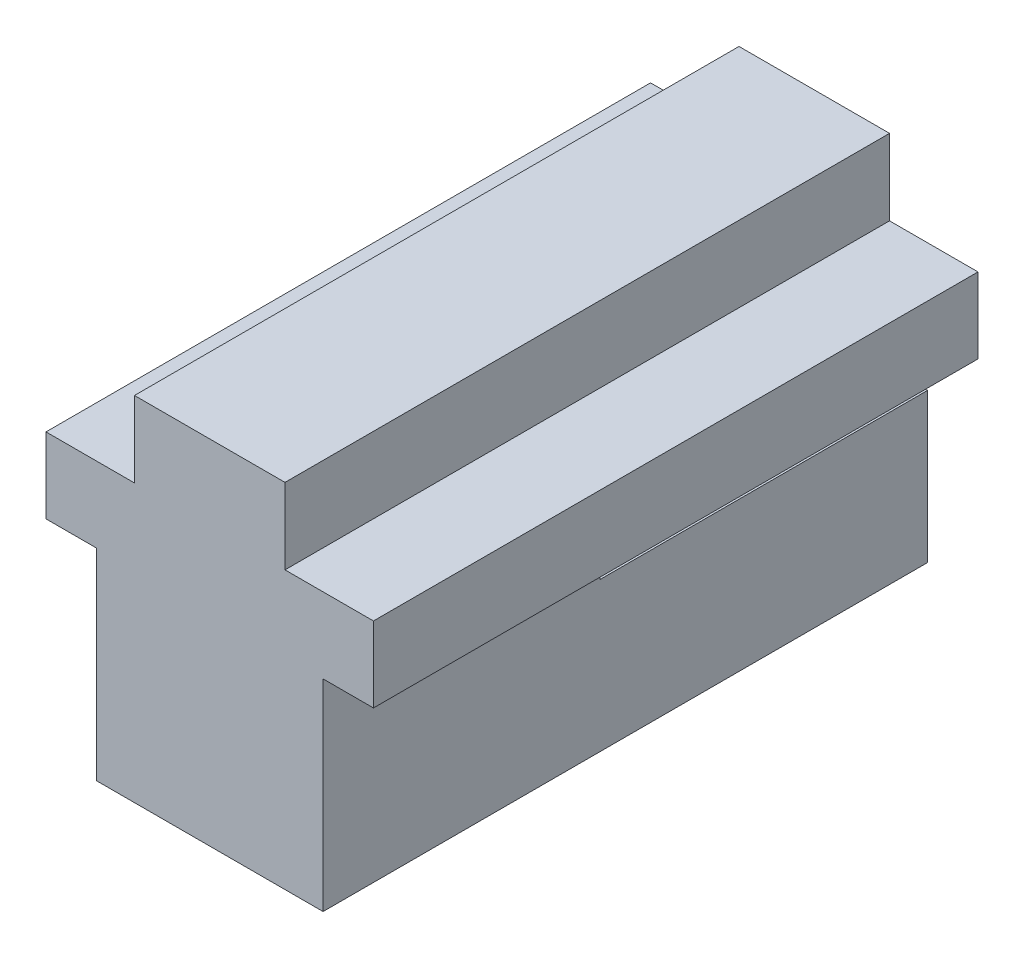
SolidWorks part; units mm, degrees
ref_plane "Front Plane" through (0, 0, 0) normal (0, 0, 1) x (1, 0, 0)
ref_plane "Top Plane" through (0, 0, 0) normal (0, 1, 0) x (1, 0, 0)
ref_plane "Right Plane" through (0, 0, 0) normal (1, 0, 0) x (0, 0, -1)
sketch "Sketch2" plane through (0, 0, 0) normal (0, 0, 1) x (1, 0, 0)
  line L0 (31.9151, -3.1496) -> (38.2651, -3.1496)
  line L1 (-3.0099, -3.1496) -> (3.3401, -3.1496)
  line L2 (-3.0099, -3.1496) -> (-3.0099, 6.35)
  line L3 (-3.0099, 6.35) -> (8.1407, 6.35)
  line L4 (38.2651, -3.1496) -> (38.2651, 6.35)
  line L5 (27.1145, 6.35) -> (38.2651, 6.35)
  line L6 (3.3401, -3.1496) -> (3.3401, -28.5496)
  line L7 (3.3401, -28.5496) -> (31.9151, -28.5496)
  line L8 (31.9151, -3.1496) -> (31.9151, -28.5496)
  line L9 (8.1407, 15.9004) -> (27.1145, 15.9004)
  line L10 (8.1407, 6.35) -> (8.1407, 15.9004)
  line L12 (27.1145, 6.35) -> (27.1145, 15.9004)
  dimension "D1" = 11.1506
  dimension "D2" = 41.275
  dimension "D3" = 28.575
  dimension "D4" = 11.1506
  dimension "D5" = 18.9738
  dimension "D6" = 6.35
  dimension "D7" = 9.4996
  dimension "D8" = 9.5504
  dimension "D9" = 6.35
  dimension "D10" = 44.45
  dimension "D11" = 9.4996
extrude "Boss-Extrude1" add sketch "Sketch2" against normal blind 76.2
sketch "Sketch3" plane through (0, -28.5496, 0) normal (0, -1, 0) x (1, 0, 0)
  line L1 (3.3401, -76.2) -> (3.3401, 0) construction
  line L2 (3.3401, -76.2) -> (31.9151, -76.2) construction
  line L4 (3.3401, 0) -> (31.9151, 0) construction
  circle A0 centre (8.1026, -17.4625) radius 2.3876
  circle A1 centre (27.1526, -17.4625) radius 2.3876
  dimension "D1" = 4.7752
  dimension "D2" = 4.7752
  dimension "D5" = 58.7375
  dimension "D6" = 17.4625
  dimension "D3" = 19.05
  dimension "D4" = 4.7625
extrude "Cut-Extrude1" cut sketch "Sketch3" against normal blind 6.35
hole_wizard "#10-32 Tapped Hole1" positions "Sketch4" profile "Sketch5" tap size "#10-32" standard "ANSI Inch"
sketch "Sketch4" plane through (0, -28.5496, 0) normal (0, -1, 0) x (-1, 0, 0)
  line L0 (-3.3401, 76.2) -> (-31.9151, 76.2) construction
  circle A2 centre (-8.1026, 17.4625) radius 2.3876 construction
  point P0 (-17.6276, 4.7625)
  point P2 (-17.6276, 30.1625)
  point P33 (44.3243, 39.2894)
  dimension "D2" = 12.7
  dimension "D1" = 12.7
  dimension "D3" = 9.525
  dimension "D4" = 9.525
  dimension "D5" = 46.0375
sketch "Sketch5" plane through (17.6276, -28.5496, -4.7625) normal (1, 0, 0) x (0, 0, -1)
  line L0 (0, 0) -> (0, 13.1513)
  line L1 (0, 13.1513) -> (2.0193, 11.938)
  line L2 (2.0193, 11.938) -> (2.0193, 1.0287)
  line L3 (2.0193, 1.0287) -> (3.048, 0)
  line L5 (3.048, 0) -> (0, 0)
  line L6 (-2.0193, 1.0287) -> (-3.048, 0) construction
  line L10 (0, 13.1513) -> (-2.0193, 11.938) construction
  line L11 (0, -6.35) -> (0, 107.95) construction
  dimension "Tap Drill Dia." = 4.0386
  dimension "Tap Drill Depth" = 11.938
  dimension "Near C'Sink Dia." = 6.096
  dimension "Near C'Sink Angle" = 90
  dimension "Drill Angle" = 118
sketch "Sketch6" plane through (3.3401, 0, 0) normal (-1, 0, 0) x (0, 0, 1)
  line L0 (-76.2, -3.1496) -> (-76.2, -28.5496) construction
  line L1 (-76.2, -3.1496) -> (-34.925, -3.1496)
  line L2 (-76.2, -3.1496) -> (-76.2, -9.7536)
  line L3 (-76.2, -9.7536) -> (-34.925, -9.7536)
  line L4 (-34.925, -3.1496) -> (-34.925, -9.7536)
  line L6 (-76.2, -28.5496) -> (0, -28.5496) construction
  dimension "D1" = 41.275
  dimension "D2" = 6.604
  dimension "D3" = 18.796
extrude "Cut-Extrude2" cut sketch "Sketch6" against normal through all both and the other way through all
